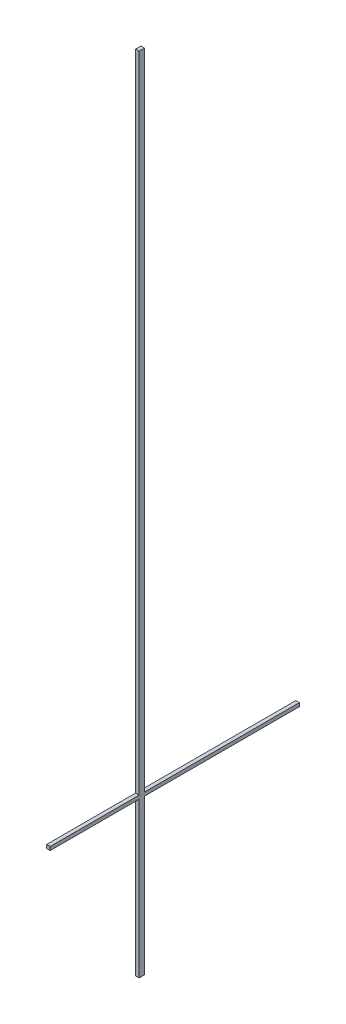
SolidWorks part; units mm, degrees
ref_plane "Front Plane" through (0, 0, 0) normal (0, 0, 1) x (1, 0, 0)
ref_plane "Top Plane" through (0, 0, 0) normal (0, 1, 0) x (1, 0, 0)
ref_plane "Right Plane" through (0, 0, 0) normal (1, 0, 0) x (0, 0, -1)
sketch "Sketch1" plane through (0, 0, 0) normal (0, 1, 0) x (1, 0, 0)
  line L1 (0, 0) -> (20, 0)
  line L2 (0, 0) -> (0, 30)
  line L3 (0, 30) -> (20, 30)
  line L4 (20, 0) -> (20, 30)
extrude "Boss-Extrude1" add sketch "Sketch1" along normal blind 2710
sketch "Sketch2" plane through (0, 0, 0) normal (0, -1, 0) x (1, 0, 0)
  line L1 (0, 0) -> (20, 0)
  line L2 (0, 0) -> (0, -30)
  line L3 (0, -30) -> (20, -30)
  line L4 (20, 0) -> (20, -30)
extrude "Boss-Extrude2" add sketch "Sketch2" along normal blind 1800
sketch "Sketch3" plane through (0, 0, 0) normal (0, 0, 1) x (1, 0, 0)
  text T0 "1"
sketch "Sketch4" plane through (0, 0, -30) normal (0, 0, -1) x (-1, 0, 0)
  line L0 (-10, -1800) -> (-10, -930) construction
  line L1 (0, -1800) -> (-20, -1800) construction
  line L2 (-10, -930) -> (-20, -930) construction
  line L3 (-20, 2710) -> (-20, -1800) construction
  line L4 (-10, -930) -> (0, -930) construction
  line L5 (0, 2710) -> (0, -1800) construction
  line L6 (0, -930) -> (0, -910) construction
  line L8 (-20, -930) -> (0, -930)
  line L9 (-20, -930) -> (-20, -910)
  line L10 (-20, -910) -> (0, -910)
  line L11 (0, -930) -> (0, -910)
extrude "Boss-Extrude3" add sketch "Sketch4" along normal blind 870
sketch "Sketch5" plane through (0, 0, 0) normal (0, 0, 1) x (1, 0, 0)
  line L0 (0, -1800) -> (0, -930) construction
  line L1 (0, 2710) -> (0, -1800) construction
  line L2 (0, -930) -> (20, -930) construction
  line L3 (20, 2710) -> (20, -1800) construction
  line L4 (20, -930) -> (20, -910) construction
  line L6 (0, -930) -> (20, -930)
  line L7 (0, -930) -> (0, -910)
  line L8 (0, -910) -> (20, -910)
  line L9 (20, -930) -> (20, -910)
extrude "Boss-Extrude4" add sketch "Sketch5" along normal blind 500
